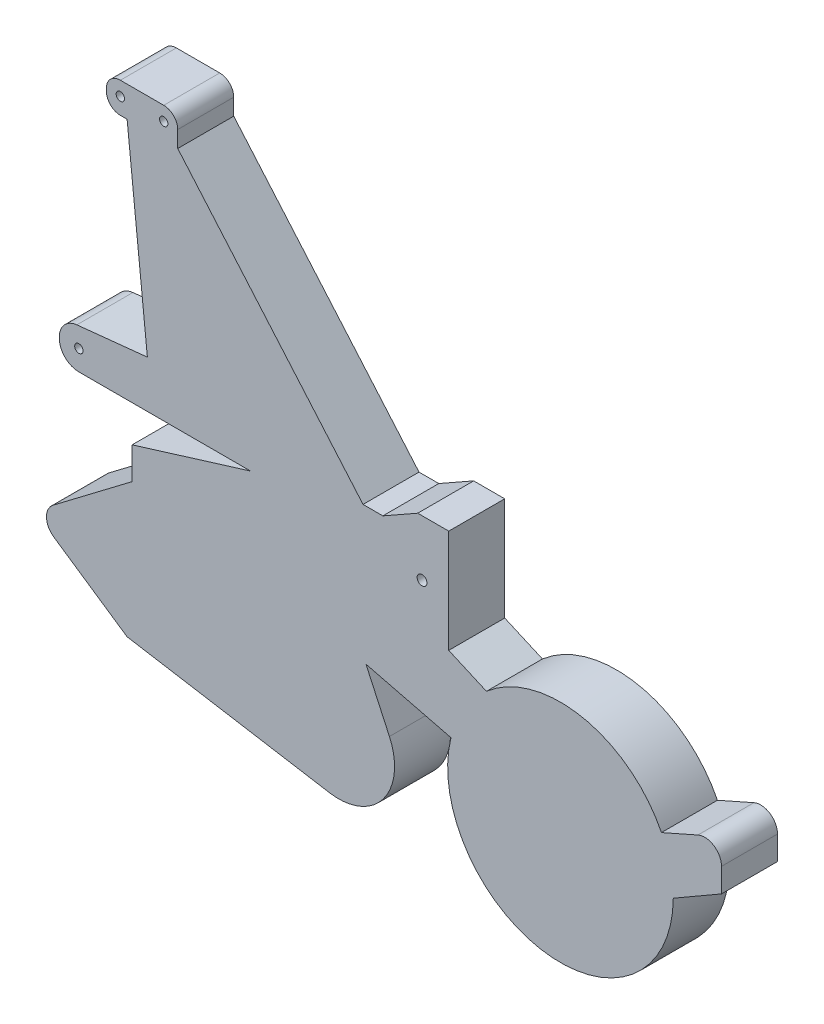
SolidWorks part; units mm, degrees
ref_plane "Plan de face" through (0, 0, 0) normal (0, 0, 1) x (1, 0, 0)
ref_plane "Plan de dessus" through (0, 0, 0) normal (0, 1, 0) x (1, 0, 0)
ref_plane "Plan de droite" through (0, 0, 0) normal (1, 0, 0) x (0, 0, -1)
sketch "Esquisse1" plane through (0, 0, 0) normal (0, 0, 1) x (1, 0, 0)
  line L0 (77.8648, -50.2) -> (69.2493, -55.1795)
  line L1 (77.8648, -50.2) -> (77.8648, -45.9416)
  line L2 (73.6509, -43.1982) -> (67.1356, -46.0811)
  line L3 (29.5436, -50.2) -> (14.3591, -46.4213)
  line L4 (14.3591, -46.4213) -> (18.55, -55.5102)
  line L5 (7.8199, -69.5606) -> (-28.3038, -63.5211)
  line L6 (-28.3038, -63.5211) -> (-41.3896, -54.6381)
  line L7 (-41.517, -49.7653) -> (-27.3975, -39.0617)
  line L8 (-27.3975, -39.0617) -> (-27.3975, -33.3652)
  line L9 (-27.3975, -33.3652) -> (-6.239, -26.855)
  line L10 (-6.239, -26.855) -> (-36.9181, -26.855)
  line L11 (-40.4181, -23.355) -> (-40.4181, -23.23)
  line L12 (-37.2782, -19.7486) -> (-24.6849, -18.4458)
  line L13 (-24.6849, -18.4458) -> (-25.3129, -12.3747)
  line L14 (-25.3129, -12.3747) -> (-28.3038, 16.5374)
  line L15 (-28.3038, 16.5374) -> (-29.5089, 16.5374)
  line L16 (-32.0089, 19.0374) -> (-32.0089, 19.4722)
  line L17 (-29.5089, 21.9722) -> (-21.7596, 21.9722)
  line L18 (-19.2596, 19.4722) -> (-19.2596, 16.5374)
  line L19 (-19.2596, 16.5374) -> (13.8344, -21.9722)
  line L20 (13.8344, -21.9722) -> (17.372, -21.9722)
  line L21 (17.372, -21.9722) -> (23.5998, -18.4458)
  line L22 (23.5998, -18.4458) -> (29.1427, -18.4458)
  line L23 (29.1427, -18.4458) -> (29.1427, -36.8917)
  line L24 (29.1427, -36.8917) -> (35.881, -39.8554)
  arc A0 (29.5436, -50.2) -> (69.2493, -55.1795) centre (49.0984, -55.0662) ccw
  arc A1 (67.1356, -46.0811) -> (35.881, -39.8554) centre (49.0984, -55.0662) ccw
  arc A2 (-40.4181, -23.23) -> (-37.2782, -19.7486) centre (-36.9181, -23.23) cw
  arc A3 (-36.9181, -26.855) -> (-40.4181, -23.355) centre (-36.9181, -23.355) cw
  arc A4 (-32.0089, 19.4722) -> (-29.5089, 21.9722) centre (-29.5089, 19.4722) cw
  arc A5 (-29.5089, 16.5374) -> (-32.0089, 19.0374) centre (-29.5089, 19.0374) cw
  arc A6 (-41.3896, -54.6381) -> (-41.517, -49.7653) centre (-39.7047, -52.156) cw
  arc A7 (7.8199, -69.5606) -> (18.55, -55.5102) centre (9.4689, -59.6975) ccw
  arc A8 (73.6509, -43.1982) -> (77.8648, -45.9416) centre (74.8648, -45.9416) cw
  arc A9 (-19.2596, 19.4722) -> (-21.7596, 21.9722) centre (-21.7596, 19.4722) ccw
  dimension "D1" = 20.1512
  dimension "D2" = 3.5
  dimension "D3" = 2.5
  dimension "D4" = 3
  dimension "D5" = 10
  dimension "D6" = 3
  dimension "D7" = 2.5
extrude "Extrusion1" add sketch "Esquisse1" against normal blind 10
sketch "Esquisse4" plane through (0, 0, 0) normal (0, 0, 1) x (1, 0, 0)
  circle A0 centre (-29.5089, 19.4722) radius 0.75
  circle A1 centre (-36.9181, -23.23) radius 0.75
  circle A2 centre (-21.7596, 19.4722) radius 0.75
  circle A3 centre (179.1632, 81.1853) radius 0.75
  arc A4 (-37.2782, -19.7486) -> (-40.4181, -23.23) centre (-36.9181, -23.23) ccw construction
  arc A5 (-29.5089, 21.9722) -> (-32.0089, 19.4722) centre (-29.5089, 19.4722) ccw construction
  arc A6 (-19.2596, 19.4722) -> (-21.7596, 21.9722) centre (-21.7596, 19.4722) ccw construction
  circle A7 centre (179.1632, 81.1853) radius 10 construction
  dimension "D1" = 1.5
  dimension "D2" = 1.5
  dimension "D3" = 1.5
extrude "Enlèv. mat.-Extru.1" cut sketch "Esquisse4" against normal through all
scale "Echelle1" scale about centroid uniform scaling yes scale factor 11.36
sketch "Esquisse5" plane through (0, 0, 51.8) normal (0, 0, 1) x (1, 0, 0)
  line L2 (233.3338, 194.5135) -> (170.3666, 194.5135) construction
  line L3 (233.3338, -15.0311) -> (233.3338, 194.5135) construction
  circle A0 centre (179.1632, 81.1853) radius 10
  dimension "D1" = 20
  dimension "D2" = 54.1707
  dimension "D3" = 113.3282
extrude "Enlèv. mat.-Extru.2" cut sketch "Esquisse5" against normal through all
